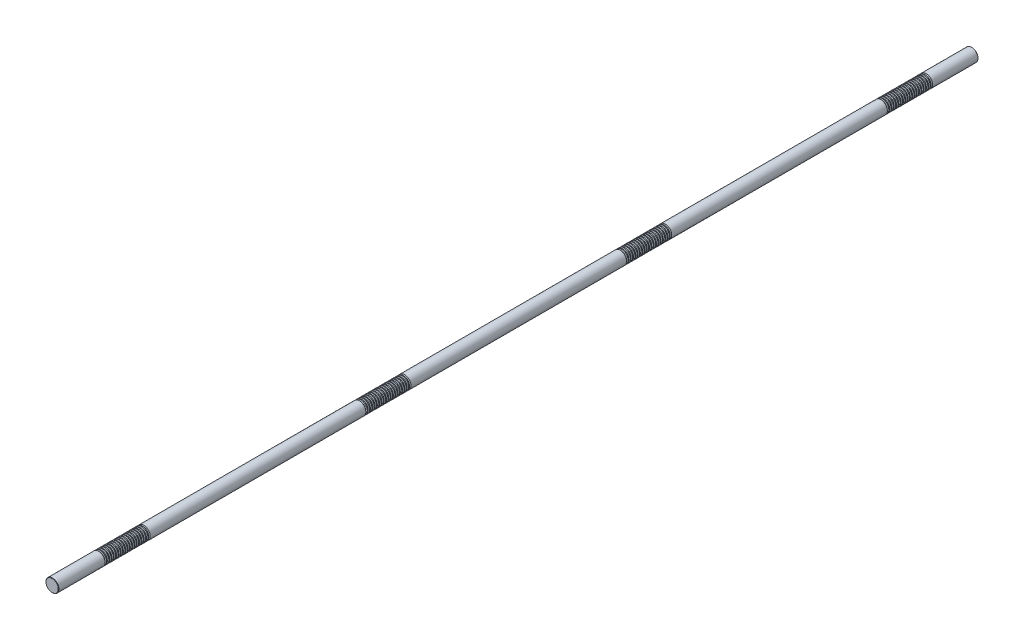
SolidWorks part; units mm, degrees
ref_plane "Front Plane" through (0, 0, 0) normal (0, 0, 1) x (1, 0, 0)
ref_plane "Top Plane" through (0, 0, 0) normal (0, 1, 0) x (1, 0, 0)
ref_plane "Right Plane" through (0, 0, 0) normal (1, 0, 0) x (0, 0, -1)
sketch "Sketch1" plane through (0, 0, 0) normal (0, 0, 1) x (1, 0, 0)
  circle A0 centre (0, 0) radius 14
  dimension "D1" = 28
extrude "Boss-Extrude1" add sketch "Sketch1" along normal mid plane 2000
chamfer "Chamfer1" distance 0.7 angle 45 2 edges at (14, 0, -1000) (14, 0, 1000)
sketch "Sketch2" plane through (0, 0, 0) normal (1, 0, 0) x (0, 0, -1)
  line L0 (900.3684, 14) -> (897.1316, 14)
  line L1 (999.3, 14) -> (-999.3, 14) construction
  line L2 (897.1316, 14) -> (897.8684, 11.25)
  line L3 (897.8684, 11.25) -> (899.6316, 11.25)
  line L4 (899.6316, 11.25) -> (900.3684, 14)
  line L5 (1000, -13.3) -> (1000, 13.3) construction
  point P4 (898.75, 14)
  point P7 (898.75, 11.25)
  point P8 (900, 12.625)
  point P9 (897.5, 12.625)
  dimension "D1" = 2.5
  dimension "D2" = 100
  dimension "D3" = 2.75
  dimension "D4" = 30
revolve "Cut-Revolve1" cut sketch "Sketch2" angle 360 about axis through (0, 0, 1000) along (0, 0, -1)
pattern_linear "LPattern1" count 20 spacing 5 along (0, 0, 1) of "Cut-Revolve1"
pattern_linear "LPattern2" count 4 spacing 567 along (0, 0, 1) of "Cut-Revolve1", "LPattern1"
